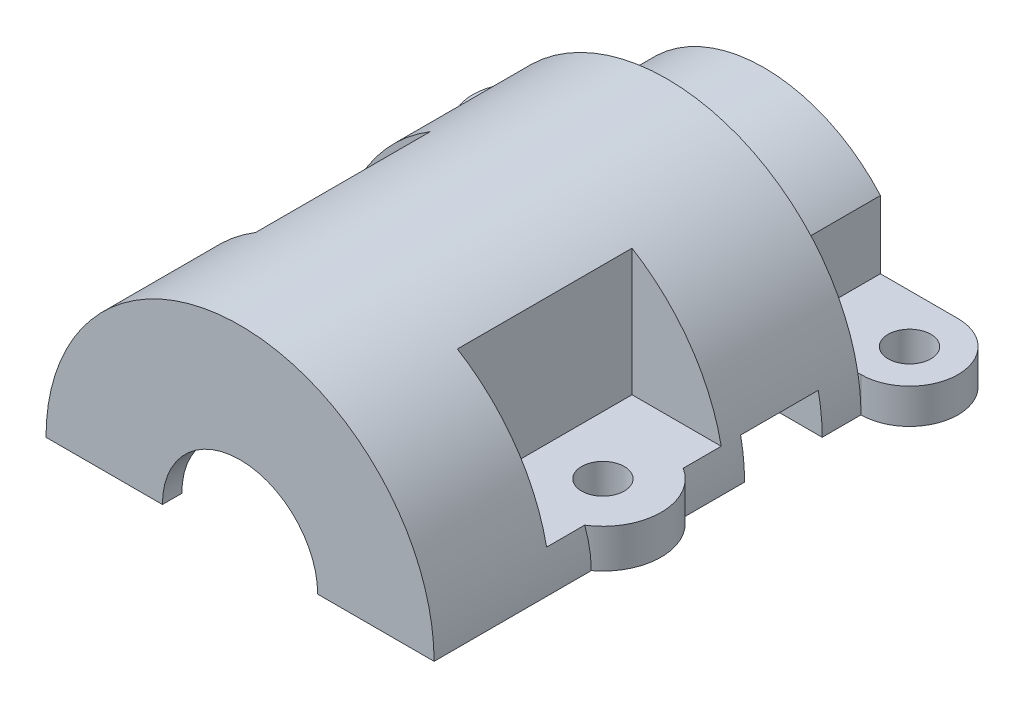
SolidWorks part; units mm, degrees
ref_plane "Front Plane" through (0, 0, 0) normal (0, 0, 1) x (1, 0, 0)
ref_plane "Top Plane" through (0, 0, 0) normal (0, 1, 0) x (1, 0, 0)
ref_plane "Right Plane" through (0, 0, 0) normal (1, 0, 0) x (0, 0, -1)
sketch "Sketch1" plane through (0, 0, 0) normal (0, 0, 1) x (1, 0, 0)
  circle A0 centre (0, 0) radius 12.7
  dimension "D1" = 25.4
extrude "Boss-Extrude1" add sketch "Sketch1" along normal blind 34.29
sketch "Sketch2" plane through (0, 0, 34.29) normal (0, 0, 1) x (1, 0, 0)
  line L1 (-12.7, 0) -> (12.7, 0)
  line L2 (-12.7, 0) -> (-12.7, -14.5535)
  line L3 (-12.7, -14.5535) -> (12.7, -14.5535)
  line L4 (12.7, 0) -> (12.7, -14.5535)
  circle A0 centre (0, 0) radius 12.7 construction
extrude "Cut-Extrude1" cut sketch "Sketch2" against normal through all
sketch "Sketch3" plane through (0, 0, 0) normal (0, -1, 0) x (1, 0, 0)
  line L0 (0, -2.0167) -> (0, 53.0196) construction
  line L1 (5.08, 34.29) -> (5.08, 33.02)
  line L2 (12.7, 34.29) -> (-12.7, 34.29) construction
  line L3 (5.08, 33.02) -> (7.9375, 33.02)
  line L4 (7.9375, 33.02) -> (7.9375, 27.94)
  line L5 (7.9375, 27.94) -> (5.588, 27.94)
  line L6 (5.588, 27.94) -> (5.588, 13.97)
  line L7 (5.588, 13.97) -> (9.525, 13.97)
  line L8 (9.525, 13.97) -> (9.525, 8.89)
  line L9 (9.525, 8.89) -> (8.128, 8.89)
  line L10 (8.128, 8.89) -> (8.128, 0)
  line L11 (12.7, 0) -> (-12.7, 0) construction
  line L12 (8.128, 0) -> (0, 0)
  line L13 (5.08, 34.29) -> (0, 34.29)
  line L14 (0, 0) -> (0, 34.29)
  point P7 (5.08, 33.655)
  dimension "D1" = 7.9375
  dimension "D2" = 5.08
  dimension "D3" = 5.588
  dimension "D4" = 1.27
  dimension "D5" = 5.08
  dimension "D6" = 13.97
  dimension "D7" = 5.08
  dimension "D8" = 9.525
  dimension "D9" = 8.128
revolve "Cut-Revolve1" cut sketch "Sketch3" angle 360 about L0
sketch "Sketch5" plane through (0, 0, 0) normal (0, -1, 0) x (-1, 0, 0)
  line L0 (5.08, -34.29) -> (12.7, -34.29) construction
  line L1 (14.2013, -26.67) -> (8.128, -26.67)
  line L2 (14.2013, -26.67) -> (14.2013, -15.24)
  line L3 (14.2013, -15.24) -> (8.128, -15.24)
  line L4 (8.128, -26.67) -> (8.128, -15.24)
  line L5 (9.525, -13.97) -> (5.588, -13.97) construction
  line L6 (5.588, -13.97) -> (5.588, -27.94) construction
  line L7 (0, -41.0612) -> (0, 2.7565) construction
  line L8 (-14.2013, -15.24) -> (-8.128, -15.24)
  line L9 (-8.128, -26.67) -> (-8.128, -15.24)
  line L10 (-14.2013, -26.67) -> (-8.128, -26.67)
  line L11 (-14.2013, -26.67) -> (-14.2013, -15.24)
  dimension "D1" = 7.62
  dimension "D2" = 1.27
  dimension "D3" = 2.54
extrude "Cut-Extrude2" cut sketch "Sketch5" against normal through all from offset 2.54
sketch "Sketch6" plane through (0, 0, 0) normal (1, 0, 0) x (0, 0, -1)
  line L0 (-8.89, 9.525) -> (-8.89, 0) construction
  line L1 (-13.97, 0) -> (-8.89, 0)
  line L2 (-13.97, 0) -> (-13.97, 2.54)
  line L3 (-13.97, 2.54) -> (-8.89, 2.54)
  line L4 (-8.89, 0) -> (-8.89, 2.54)
  dimension "D1" = 2.54
extrude "Cut-Extrude3" cut sketch "Sketch6" against normal through all both and the other way through all
sketch "Sketch7" plane through (0, 0, 0) normal (0, -1, 0) x (-1, 0, 0)
  line L0 (-9.1801, -8.89) -> (9.1801, -8.89) construction
  line L1 (-12.7, 0) -> (-6.35, 0)
  line L2 (-12.7, 0) -> (-12.7, -8.89)
  line L3 (-12.7, -8.89) -> (-6.35, -8.89)
  line L4 (-6.35, 0) -> (-6.35, -8.89)
  line L5 (0, 0) -> (0, -39.1785) construction
  line L6 (12.7, -8.89) -> (6.35, -8.89)
  line L7 (6.35, 0) -> (6.35, -8.89)
  line L8 (12.7, 0) -> (6.35, 0)
  line L9 (12.7, 0) -> (12.7, -8.89)
  dimension "D1" = 6.35
extrude "Boss-Extrude2" add sketch "Sketch7" against normal up to surface (5.0736 mm away)
sketch "Sketch8" plane through (0, 0, 0) normal (0, 0, -1) x (-1, 0, 0)
  line L0 (12.4434, 2.54) -> (9.8374, 2.54)
  line L1 (6.35, 0) -> (12.7, 0) construction
  line L2 (-9.8374, 2.54) -> (-12.4434, 2.54)
  arc A0 (9.8374, 2.54) -> (-9.8374, 2.54) centre (0, 0) ccw
  arc A2 (12.4434, 2.54) -> (-12.4434, 2.54) centre (0, 0) ccw
  dimension "D1" = 20.32
  dimension "D2" = 2.54
extrude "Cut-Extrude5" cut sketch "Sketch8" against normal blind 6.35
sketch "Sketch10" plane through (0, 0, 0) normal (0, 0, -1) x (-1, 0, 0)
  line L0 (-9.8374, 2.54) -> (-7.62, 2.54)
  line L1 (-7.62, 2.54) -> (-7.62, 7.6543)
  line L2 (-7.62, 7.6543) -> (-9.8374, 7.6543)
  line L3 (-9.8374, 7.6543) -> (-9.8374, 2.54)
  line L4 (-6.35, 5.0736) -> (-6.35, 0) construction
  line L5 (0, 0) -> (0, 14.5661) construction
  line L6 (7.62, 7.6543) -> (9.8374, 7.6543)
  line L7 (7.62, 2.54) -> (7.62, 7.6543)
  line L8 (9.8374, 2.54) -> (7.62, 2.54)
  line L9 (9.8374, 7.6543) -> (9.8374, 2.54)
  dimension "D1" = 1.27
extrude "Cut-Extrude6" cut sketch "Sketch10" against normal up to surface (6.35 mm away)
sketch "Sketch13" plane through (0, 2.54, 0) normal (0, 1, 0) x (1, 0, 0)
  line L0 (10.1506, -3.175) -> (12.4434, -3.175) construction
  line L1 (12.4434, -6.35) -> (12.4434, 0) construction
  line L2 (-12.7, -3.175) -> (-9.2105, -3.175) construction
  line L3 (-12.7, 0) -> (-9.2105, 0)
  line L4 (-12.7, -6.35) -> (-9.2105, -6.35)
  line L5 (-9.2105, 0) -> (-9.2105, -6.35)
  line L6 (10.1506, 0) -> (10.1506, -6.35)
  line L7 (10.1506, 0) -> (12.7, 0)
  line L8 (10.1506, -3.175) -> (12.7, -3.175) construction
  line L9 (10.1506, -6.35) -> (12.7, -6.35)
  arc A0 (-12.7, 0) -> (-12.7, -6.35) centre (-12.7, -3.175) ccw
  arc A1 (12.7, -6.35) -> (12.7, 0) centre (12.7, -3.175) ccw
  point P6 (0, -3.175)
  dimension "D1" = 6.35
  dimension "D2" = 25.4
extrude "Boss-Extrude4" add sketch "Sketch13" against normal up to surface (2.54 mm away)
sketch "Sketch14" plane through (0, 2.54, 0) normal (0, 1, 0) x (1, 0, 0)
  circle A0 centre (-12.7, -3.175) radius 1.397
  circle A1 centre (12.7, -3.175) radius 1.397
  dimension "D1" = 2.794
  dimension "D2" = 2.794
extrude "Cut-Extrude8" cut sketch "Sketch14" against normal through all
sketch "Sketch15" plane through (0, 2.54, 0) normal (0, 1, 0) x (1, 0, 0)
  line L1 (-8.128, -15.24) -> (-8.128, -26.67) construction
  line L4 (-8.128, -26.67) -> (-12.4434, -26.67) construction
  line L5 (0, 0) -> (0, -36.5481) construction
  line L6 (7.62, 0) -> (-7.62, 0) construction
  circle A0 centre (-10.414, -20.955) radius 1.397
  circle A1 centre (10.414, -20.955) radius 1.397
  dimension "D3" = 2.794
  dimension "D1" = 2.286
  dimension "D2" = 5.715
sketch "Sketch17" plane through (0, 2.54, 0) normal (0, 1, 0) x (1, 0, 0)
  line L0 (0, -34.29) -> (0, 0) construction
  line L1 (-12.7, -34.29) -> (12.7, -34.29) construction
  circle A0 centre (-10.414, -20.955) radius 3.81
  circle A1 centre (10.414, -20.955) radius 3.81
  dimension "D1" = 7.62
extrude "Boss-Extrude5" add sketch "Sketch17" against normal up to surface (2.54 mm away)
sketch "Sketch18" plane through (0, 2.54, 0) normal (0, 1, 0) x (1, 0, 0)
  line L0 (-10.414, -20.955) -> (-6.604, -20.955) construction
  line L1 (-10.414, -15.24) -> (-10.414, -26.67)
  line L2 (-12.4434, -15.24) -> (-8.128, -15.24) construction
  line L3 (-8.128, -26.67) -> (-12.4434, -26.67) construction
  line L4 (-10.414, -26.67) -> (-6.604, -26.67)
  line L5 (-6.604, -26.67) -> (-6.604, -15.24)
  line L6 (-6.604, -15.24) -> (-10.414, -15.24)
  line L7 (0, -34.29) -> (0, 0) construction
  line L8 (-12.7, -34.29) -> (12.7, -34.29) construction
  line L9 (6.604, -26.67) -> (6.604, -15.24)
  line L10 (10.414, -26.67) -> (6.604, -26.67)
  line L11 (10.414, -15.24) -> (10.414, -26.67)
  line L12 (6.604, -15.24) -> (10.414, -15.24)
  dimension "D1" = 3.81
extrude "Cut-Extrude9" cut sketch "Sketch18" along normal through all
extrude "Cut-Extrude10" cut sketch "Sketch15" against normal through all
sketch "Sketch19" plane through (0, 2.54, 0) normal (0, 1, 0) x (1, 0, 0)
  line L0 (0, 2.4011) -> (0, -39.8073) construction
  line L1 (7.62, 0) -> (17.4507, 0)
  line L2 (7.62, 0) -> (7.62, -6.35)
  line L3 (7.62, -6.35) -> (17.4507, -6.35)
  line L4 (17.4507, 0) -> (17.4507, -6.35)
  line L5 (-7.62, -6.35) -> (-17.4507, -6.35)
  line L6 (-17.4507, 0) -> (-17.4507, -6.35)
  line L7 (-7.62, 0) -> (-17.4507, 0)
  line L8 (-7.62, 0) -> (-7.62, -6.35)
extrude "Cut-Extrude11" cut sketch "Sketch19" against normal blind 0.254
